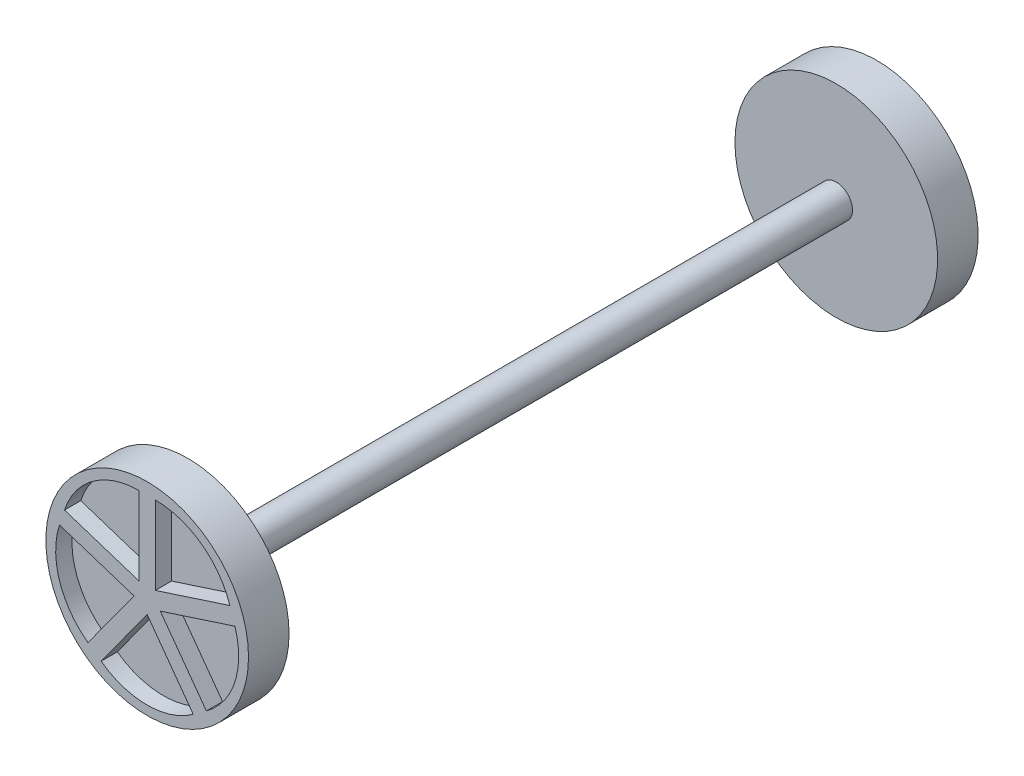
SolidWorks part; units mm, degrees
ref_plane "Front Plane" through (0, 0, 0) normal (0, 0, 1) x (1, 0, 0)
ref_plane "Top Plane" through (0, 0, 0) normal (0, 1, 0) x (1, 0, 0)
ref_plane "Right Plane" through (0, 0, 0) normal (1, 0, 0) x (0, 0, -1)
sketch "Sketch1" plane through (0, 0, 0) normal (0, 0, 1) x (1, 0, 0)
  circle A0 centre (0, 0) radius 2
  dimension "D1" = 4
extrude "Extrude1" add sketch "Sketch1" along normal mid plane 80
sketch "Sketch2" plane through (0, 0, 40) normal (0, 0, 1) x (1, 0, 0)
  circle A0 centre (0, 0) radius 12.5
  dimension "D1" = 25
extrude "Extrude2" add sketch "Sketch2" along normal blind 5
sketch "Sketch3" plane through (0, 0, -40) normal (0, 0, -1) x (-1, 0, 0)
  circle A1 centre (0, 0) radius 12.5
  circle A2 centre (0, 0) radius 12.5
  dimension "D1" = 0
extrude "Extrude3" add sketch "Sketch3" along normal blind 5
sketch "Sketch4" plane through (0, 0, 45) normal (0, 0, 1) x (1, 0, 0)
  line L0 (0, 0) -> (0, 12.5) construction
  line L1 (0, 0) -> (11.8882, 3.8627) construction
  line L2 (1, 1.3764) -> (10.1977, 4.3649)
  line L3 (1, 1.3764) -> (1, 11.0475)
  line L4 (1, 1.3764) -> (1, 12.5) construction
  line L5 (1, 1.3764) -> (11.5792, 4.8138) construction
  circle A0 centre (0, 0) radius 12.5 construction
  arc A1 (1, 11.0475) -> (10.1977, 4.3649) centre (1, 1.3764) cw
  dimension "D1" = 72
  dimension "D2" = 1
extrude "Extrude4" cut sketch "Sketch4" against normal blind 2
pattern_circular "CirPattern1" count 5 over 360 about axis through (0, 0, 0) along (0, 0, 1) of "Extrude4"
mirror "Mirror1" about plane through (0, 0, 0) normal (0, 0, 1) of "CirPattern1", "Extrude4"
